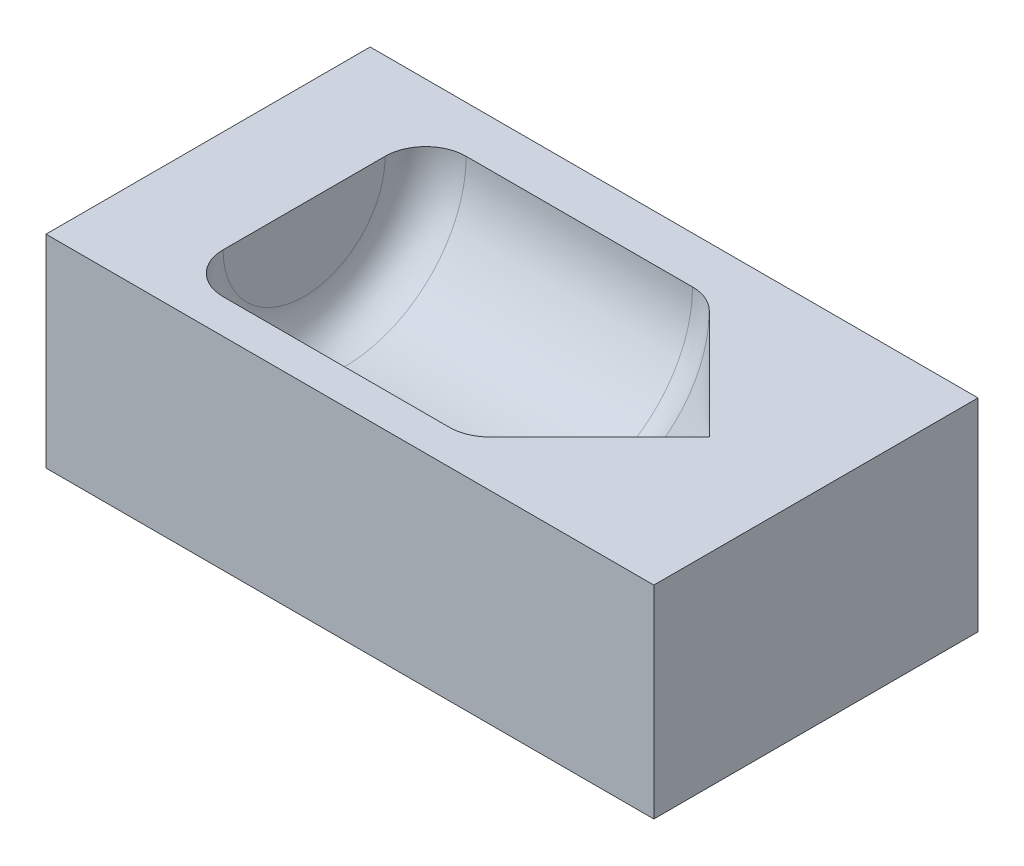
SolidWorks part; units mm, degrees
ref_plane "Front Plane" through (0, 0, 0) normal (0, 0, 1) x (1, 0, 0)
ref_plane "Top Plane" through (0, 0, 0) normal (0, 1, 0) x (1, 0, 0)
ref_plane "Right Plane" through (0, 0, 0) normal (1, 0, 0) x (0, 0, -1)
sketch "Sketch1" plane through (0, 7.9849, 0) normal (0, -1, 0) x (1, 0, 0)
  line L4 (-88.3452, 40) -> (-88.3452, -40)
  line L5 (-88.3452, -40) -> (61.6548, -40)
  line L6 (61.6548, -40) -> (61.6548, 40)
  line L7 (61.6548, 40) -> (-88.3452, 40)
  line L8 (-88.3452, 40) -> (-88.3452, -40)
  line L9 (-88.3452, -40) -> (61.6548, -40)
  line L10 (61.6548, -40) -> (61.6548, 40)
  line L11 (61.6548, 40) -> (-88.3452, 40)
  dimension "D1" = 0
extrude "Boss-Extrude1" add sketch "Sketch1" along normal blind 50
other "Cavity1"
other "Base2<1>@Assem21"
